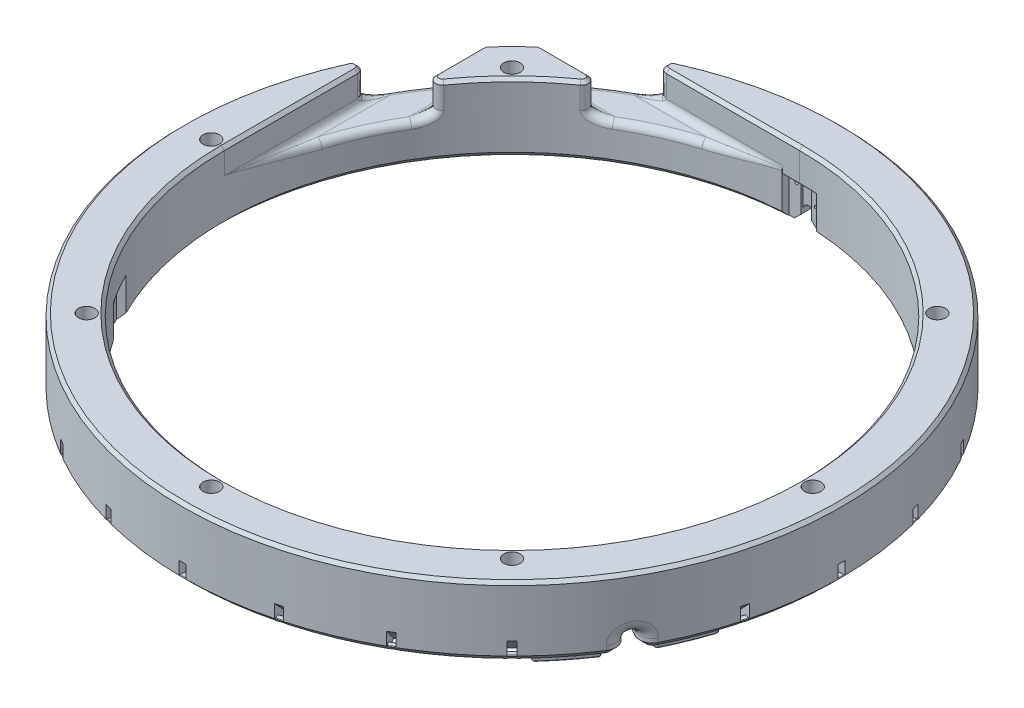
SolidWorks part; units mm, degrees
ref_plane "Front" through (0, 0, 0) normal (0, 0, 1) x (1, 0, 0)
ref_plane "Top" through (0, 0, 0) normal (0, 1, 0) x (1, 0, 0)
ref_plane "Right" through (0, 0, 0) normal (1, 0, 0) x (0, 0, -1)
sketch "Sketch1" plane through (0, 0, 0) normal (0, 1, 0) x (1, 0, 0)
  circle A0 centre (0, 0) radius 160.02
  circle A1 centre (0, 0) radius 139.7
  dimension "D1" = 320.04
  dimension "D2" = 139.7
extrude "Boss-Extrude1" add sketch "Sketch1" along normal blind 19.05
sketch "Sketch2" plane through (0, 0, 0) normal (0, 1, 0) x (1, 0, 0)
  line L0 (2.54, 142.875) -> (8.3175, 142.875)
  line L1 (-8.3175, 142.875) -> (-2.54, 142.875)
  line L2 (-8.3175, 142.875) -> (-8.3175, 0)
  line L3 (-8.3175, 0) -> (8.3175, 0)
  line L4 (8.3175, 142.875) -> (8.3175, 0)
  line L6 (-2.54, 142.875) -> (-2.54, 143.875)
  line L7 (-2.54, 143.875) -> (2.54, 143.875)
  line L8 (2.54, 142.875) -> (2.54, 143.875)
  point P4 (0, 0)
  point P10 (0, 143.875)
  dimension "D1" = 142.875
  dimension "D2" = 16.635
  dimension "D3" = 5.08
  dimension "D4" = 1
extrude "Cut-Extrude1" cut sketch "Sketch2" along normal through all
hole_wizard "Tap Drill for M2x0.4 Tap1" positions "Sketch5" profile "Sketch6" hole size "M2x0.4" standard "ANSI Metric"
sketch "Sketch5" plane through (0, 0, -142.875) normal (0, 0, 1) x (1, 0, 0)
  line L1 (-4.7625, 15.2825) -> (4.7625, 15.2825)
  line L2 (-4.7625, 15.2825) -> (-4.7625, 9.6945)
  line L3 (-4.7625, 9.6945) -> (4.7625, 9.6945)
  line L4 (4.7625, 15.2825) -> (4.7625, 9.6945)
  line L6 (0, 9.6945) -> (0, 0)
  line L8 (-2.54, 19.05) -> (-8.3175, 19.05) construction
  point P0 (-4.7625, 15.2825)
  point P2 (4.7625, 9.6945)
  point P5 (-4.7625, 15.2825)
  point P143 (0, 15.2825)
  dimension "D1" = 3.7675
  dimension "D2" = 9.525
  dimension "D3" = 5.588
sketch "Sketch6" plane through (-4.7625, 15.2825, -142.875) normal (1, 0, 0) x (0, -1, 0)
  line L0 (0, 0) -> (0, 13.1807)
  line L1 (0, 13.1807) -> (0.8, 12.7)
  line L2 (0.8, 12.7) -> (0.8, 0)
  line L5 (0.8, 0) -> (0, 0)
  line L10 (0, 13.1807) -> (-0.8, 12.7) construction
  line L11 (0, -6.35) -> (0, 107.95) construction
  dimension "Hole Dia." = 1.6
  dimension "Hole Depth" = 12.7
  dimension "Drill Angle" = 118
sketch "Sketch10" plane through (0, 0, -143.875) normal (0, 0, 1) x (1, 0, 0)
  line L1 (-2.54, 0) -> (2.54, 0)
  line L2 (-2.54, 0) -> (-2.54, 5.08)
  line L6 (2.54, 0) -> (2.54, 5.08)
  arc A0 (2.54, 5.08) -> (-2.54, 5.08) centre (0, 5.08) ccw
  dimension "D1" = 5.08
extrude "Cut-Extrude5" cut sketch "Sketch10" against normal through all
fillet "Fillet3" radius 6.35 3 edges at (2.54, 2.54, -159.9998) (-0.2939, 7.6029, -160.0197) (-2.54, 2.54, -159.9998)
pattern_circular "CirPattern1" count 3 over 360 about axis through (0, 19.05, 0) along (0, -1, 0) of "Cut-Extrude1", "Tap Drill for M2x0.4 Tap1", "Cut-Extrude5", "Fillet3"
hole_wizard "CBORE for M4 SHCS1" positions "Sketch3" profile "Sketch4" counterbore size "M4" standard "ANSI Metric"
sketch "Sketch3" plane through (0, 19.05, 0) normal (0, 1, 0) x (1, 0, 0)
  line L0 (0, 160.02) -> (0, 0)
  line L2 (0, 0) -> (103.2729, 103.2729)
  circle A0 centre (0, 0) radius 160.02 construction
  point P10 (103.2729, 103.2729)
  dimension "D1" = 45
  dimension "D2" = 146.05
sketch "Sketch4" plane through (103.2729, 19.05, -103.2729) normal (1, 0, 0) x (0, 0, 1)
  line L0 (0, 0) -> (0, 19.05)
  line L1 (0, 19.05) -> (2.15, 19.05)
  line L3 (2.15, 19.05) -> (2.15, 5)
  line L4 (2.15, 5) -> (4, 5)
  line L5 (4, 5) -> (4, 0)
  line L7 (4, 0) -> (0, 0)
  line L11 (0, -6.35) -> (0, 107.95) construction
  dimension "Thru Hole Dia." = 4.3
  dimension "Thru Hole Depth" = 19.05
  dimension "C'Bore Dia." = 8
  dimension "C'Bore Depth" = 5
hole_wizard "Tap Drill for M4x0.7 Tap2" positions "Sketch17" profile "Sketch18" hole size "M4x0.7" standard "ANSI Metric"
sketch "Sketch17" plane through (0, 19.05, 0) normal (0, 1, 0) x (1, 0, 0)
  line L0 (0, 0) -> (0, 146.05)
  line L1 (0, 146.05) -> (0, 154.94)
  point P0 (0, 154.94)
  dimension "D1" = 154.94
sketch "Sketch18" plane through (0, 19.05, -154.94) normal (1, 0, 0) x (0, 0, 1)
  line L0 (0, 0) -> (0, 18.6813)
  line L1 (0, 18.6813) -> (1.5, 17.78)
  line L2 (1.5, 17.78) -> (1.5, 0)
  line L5 (1.5, 0) -> (0, 0)
  line L10 (0, 18.6813) -> (-1.5, 17.78) construction
  line L11 (0, -6.35) -> (0, 107.95) construction
  dimension "Hole Dia." = 3
  dimension "Hole Depth" = 17.78
  dimension "Drill Angle" = 118
sketch "Sketch11" plane through (0, 0, 0) normal (0, -1, 0) x (1, 0, 0)
  line L0 (84.3678, -91.4389) -> (91.4389, -84.3678)
  line L1 (84.3678, -91.4389) -> (116.5238, -123.5948)
  line L2 (91.4389, -84.3678) -> (123.5948, -116.5238)
  line L3 (116.5238, -123.5948) -> (123.5948, -116.5238)
  line L4 (103.2729, -103.2729) -> (0, 0) construction
  point P8 (87.9034, -87.9034)
  dimension "D1" = 10
extrude "Cut-Extrude6" [suppressed] cut sketch "Sketch11" against normal blind 5
fillet "Fillet2" [suppressed] radius 3.175
pattern_circular "CirPattern2" count 8 over 360 about axis through (0, 0, 0) along (0, 1, 0) of "CBORE for M4 SHCS1"
pattern_circular "CirPattern5" [suppressed] count 12 over 360
hole_wizard "Tap Drill for M4x0.7 Tap1" positions "Sketch12" profile "Sketch13" hole size "M4x0.7" standard "ANSI Metric"
sketch "Sketch12" [suppressed] plane through (0, 0, 0) normal (0, -1, 0) x (-1, 0, 0)
  line L0 (0, 0) -> (-103.2729, -103.2729)
  line L2 (0, 0) -> (0, -146.05)
  point P0 (0, -146.05)
sketch "Sketch13" plane through (0, 0, 146.05) normal (1, 0, 0) x (0, 0, -1)
  line L0 (0, 0) -> (0, 10.9914)
  line L1 (0, 10.9914) -> (1.65, 10)
  line L2 (1.65, 10) -> (1.65, 0)
  line L5 (1.65, 0) -> (0, 0)
  line L10 (0, 10.9914) -> (-1.65, 10) construction
  line L11 (0, -6.35) -> (0, 107.95) construction
  dimension "Hole Dia." = 3.3
  dimension "Hole Depth" = 10
  dimension "Drill Angle" = 118
pattern_circular "CirPattern3" [suppressed] count 12 over 360
chamfer "Chamfer1" distance 3.175 angle 45 18 edges at (-120.9837, 0, -69.85) (-134.5929, 0, 82.94) (-139.1245, 0, 75.0909) (-127.0263, 0, 76.2716) (-129.5663, 0, 71.8722) (139.1245, 0, 75.0909) (134.5929, 0, 82.94) (129.5663, 0, 71.8722) (127.0263, 0, 76.2716) (2.54, 0, -148.1438) (-138.5814, 0, -80.01) (-2.54, 0, -148.1438) (-4.5317, 0, -158.0308) (4.5317, 0, -158.0308) (0, 0, 160.02) (138.5814, 0, -80.01) (0, 0, 139.7) (120.9837, 0, -69.85)
sketch "Sketch14" plane through (0, 0, 0) normal (1, 0, 0) x (0, 0, -1)
  line L0 (-160.02, 3.175) -> (-156.845, 0) construction
  line L1 (-157.3259, 3.175) -> (-159.385, 3.175)
  line L2 (-156.845, 2.6941) -> (-156.845, 0.635)
  line L3 (-161.1954, 10.6366) -> (-161.1954, -1.2598)
  line L4 (-157.3259, 3.175) -> (-156.845, 2.6941)
  line L5 (-161.1954, -1.2598) -> (-149.299, -1.2598)
  line L6 (-149.299, -1.2598) -> (-161.1954, 10.6366)
  line L7 (-160.02, 3.175) -> (-87.8931, 3.175) construction
  line L8 (-156.845, 0) -> (-86.1492, 0) construction
  line L9 (-157.0855, 2.9345) -> (-158.4325, 1.5875) construction
  line L10 (-159.7025, 2.8575) -> (-159.7025, 0.3175)
  line L11 (-159.7025, 0.3175) -> (-157.1625, 0.3175)
  arc A0 (-159.385, 3.175) -> (-159.7025, 2.8575) centre (-159.385, 2.8575) ccw
  arc A1 (-156.845, 0.635) -> (-157.1625, 0.3175) centre (-157.1625, 0.635) cw
  dimension "D2" = 0.3175
  dimension "D1" = 1.905
  dimension ".075" = 2.54
extrude "Cut-Extrude7" cut sketch "Sketch14" against normal mid plane 3.429
fillet "Fillet7" [suppressed] radius 0.635
pattern_circular "CirPattern4" count 24 over 360 about axis through (0, 0, 0) along (0, 1, 0) of "Cut-Extrude7", "Fillet7"
fillet "Fillet4" [suppressed] radius 0.381
hole_wizard "CBORE for M4 SHCS2" positions "Sketch15" profile "Sketch16" counterbore size "M4" standard "ANSI Metric"
sketch "Sketch15" plane through (0, 19.05, 0) normal (0, 1, 0) x (1, 0, 0)
  line L1 (-135.8193, 63.3336) -> (0, 0)
  line L3 (-85.9562, 122.7581) -> (0, 0)
  line L5 (0, 0) -> (0, 129.3038)
  line L7 (-114.7994, 96.3282) -> (0, 0)
  arc A0 (-135.8193, 63.3336) -> (-85.9562, 122.7581) centre (0, 0) cw
  circle A2 centre (0, 0) radius 160.02 construction
  point P0 (-135.8193, 63.3336)
  point P2 (-85.9562, 122.7581)
  dimension "D3" = 149.86
  dimension "D1" = 30
  dimension "D2" = 50
sketch "Sketch16" plane through (-135.8193, 19.05, -63.3336) normal (1, 0, 0) x (0, 0, 1)
  line L0 (0, 0) -> (0, 19.05)
  line L1 (0, 19.05) -> (2.15, 19.05)
  line L3 (2.15, 19.05) -> (2.15, 4)
  line L4 (2.15, 4) -> (4, 4)
  line L5 (4, 4) -> (4, 0)
  line L7 (4, 0) -> (0, 0)
  line L11 (0, -6.35) -> (0, 107.95) construction
  dimension "Thru Hole Dia." = 4.3
  dimension "Thru Hole Depth" = 19.05
  dimension "C'Bore Dia." = 8
  dimension "C'Bore Depth" = 4
sketch "Sketch19" plane through (0, 0, 0) normal (0, -1, 0) x (1, 0, 0)
  line L0 (0, -154.94) -> (0, 0) construction
  line L1 (10.6967, -152.97) -> (0, 0) construction
  line L2 (0, 0) -> (31.8819, -149.9926) construction
  arc A0 (31.8819, -149.9926) -> (10.6967, -152.97) centre (0, 0) cw construction
  arc A1 (10.7853, -154.2369) -> (32.146, -151.2348) centre (0, 0) ccw
  arc A2 (10.6081, -151.7031) -> (31.6179, -148.7503) centre (0, 0) ccw
  arc A3 (10.6081, -151.7031) -> (10.7853, -154.2369) centre (10.6967, -152.97) ccw
  arc A4 (32.146, -151.2348) -> (31.6179, -148.7503) centre (31.8819, -149.9926) ccw
  arc A5 (-31.8819, -149.9926) -> (-10.6967, -152.97) centre (0, 0) ccw construction
  arc A6 (-10.7853, -154.2369) -> (-32.146, -151.2348) centre (0, 0) cw
  arc A7 (-10.6081, -151.7031) -> (-31.6179, -148.7503) centre (0, 0) cw
  arc A8 (-10.6081, -151.7031) -> (-10.7853, -154.2369) centre (-10.6967, -152.97) cw
  arc A9 (-32.146, -151.2348) -> (-31.6179, -148.7503) centre (-31.8819, -149.9926) cw
  circle A10 centre (0, 0) radius 152.01 construction
  point P3 (21.3413, -151.8512)
  point P15 (-21.3413, -151.8512)
  dimension "D3" = 0.0635
  dimension "D4" = 1.27
  dimension "D1" = 4
  dimension "D2" = 12
extrude "Boss-Extrude2" add sketch "Sketch19" along normal blind 3.175
fillet "Fillet5" radius 0.381 8 edges at (21.1645, -3.175, -150.5935) (33.1242, -3.175, -149.7285) (21.518, -3.175, -153.1088) (9.4298, -3.175, -153.0586) (-21.518, -3.175, -153.1088) (-33.1242, -3.175, -149.7285) (-21.1645, -3.175, -150.5935) (-9.4298, -3.175, -153.0586)
fillet "Fillet6" radius 0.381 8 edges at (21.1645, 0, -150.5935) (33.1242, 0, -149.7285) (21.518, 0, -153.1088) (-21.1645, 0, -150.5935) (-9.4298, 0, -153.0586) (-21.518, 0, -153.1088) (9.4298, 0, -153.0586) (-33.1242, 0, -149.7285)
pattern_circular "CirPattern6" count 3 over 360 about axis through (0, 0, 0) along (0, 1, 0) of "Fillet6", "Fillet5", "Boss-Extrude2"
sketch "Sketch20" plane through (0, 19.05, 0) normal (0, 1, 0) x (1, 0, 0)
  circle A3 centre (-103.2729, -103.2729) radius 4 construction
  circle A4 centre (-103.2729, 103.2729) radius 4 construction
  circle A5 centre (-146.05, 0) radius 4 construction
  circle A6 centre (103.2729, 103.2729) radius 4 construction
  circle A7 centre (146.05, 0) radius 4 construction
  circle A8 centre (103.2729, -103.2729) radius 4 construction
  circle A9 centre (0, -146.05) radius 4 construction
  circle A10 centre (0, -146.05) radius 4
  circle A11 centre (103.2729, -103.2729) radius 4
  circle A12 centre (146.05, 0) radius 4
  circle A13 centre (103.2729, 103.2729) radius 4
  circle A16 centre (-103.2729, -103.2729) radius 4
  circle A17 centre (-103.2729, 103.2729) radius 4
  circle A21 centre (-146.05, 0) radius 4
  circle A22 centre (0, 0) radius 160.02 construction
  circle A23 centre (0, 0) radius 160.02
  circle A24 centre (0, 0) radius 139.7
  dimension "D1" = 279.4
extrude "Boss-Extrude3" add sketch "Sketch20" along normal blind 15.24
sketch "Sketch21" plane through (0, 34.29, 0) normal (0, 1, 0) x (1, 0, 0)
  line L0 (-119.7, 0) -> (0, 0) construction
  line L1 (-139.7, 139.7) -> (0, 139.7)
  line L2 (-139.7, 139.7) -> (-139.7, 0)
  line L3 (-139.7, 0) -> (-119.7, 0)
  line L4 (0, 139.7) -> (0, 119.7)
  line L7 (0, 119.7) -> (-119.7, 119.7)
  line L8 (-119.7, 0) -> (-119.7, 119.7)
  line L9 (0, 0) -> (0, 119.7) construction
  circle A0 centre (0, 0) radius 139.7 construction
  dimension "D1" = 20
extrude "Cut-Extrude8" cut sketch "Sketch21" against normal blind 15.24
fillet "Fillet8" radius 3.175 4 edges at (-139.7, 19.05, -39.0202) (-43.179, 19.05, -139.7) (-89.1136, 19.05, -119.7) (-119.7, 19.05, -89.1136)
fillet "Fillet9" radius 3.175 18 edges at (-139.7, 28.2575, -78.0404) (-139.4839, 21.0737, -78.426) (-93.24, 19.05, -130.0489) (-130.0489, 19.05, -93.24) (-78.5347, 20.9274, -139.4227) (-78.0404, 28.2575, -139.7) (-106.1994, 28.2575, -119.7) (-105.7762, 20.7298, -120.0741) (-120.4893, 20.13, -105.303) (-119.7, 28.2575, -106.1994) (-14.5928, 20.1589, -138.9357) (-48.523, 19.05, -131.0023) (-71.557, 20.9168, -119.982) (-137.73, 19.2876, -23.3781) (-131.0023, 19.05, -48.523) (-119.934, 21.0287, -71.6374) (-72.0278, 28.2575, -119.7) (-119.7, 28.2575, -72.0278)
chamfer "Chamfer2" distance 1.5 angle 45 14 edges at (98.7828, 34.29, 98.7828) (-139.7, 34.29, -32.3539) (-32.3539, 34.29, -139.7) (-142.205, 34.29, -67.8112) (-67.8112, 34.29, -142.205) (113.1512, 34.29, 113.1512) (-113.1512, 34.29, -113.1512) (-106.1253, 34.29, -119.4889) (-119.4889, 34.29, -106.1253) (-93.8311, 34.29, -119.7) (-119.7, 34.29, -93.8311) (-79.6501, 34.29, -117.4891) (-117.4891, 34.29, -79.6501) (-98.7828, 34.29, -98.7828)
